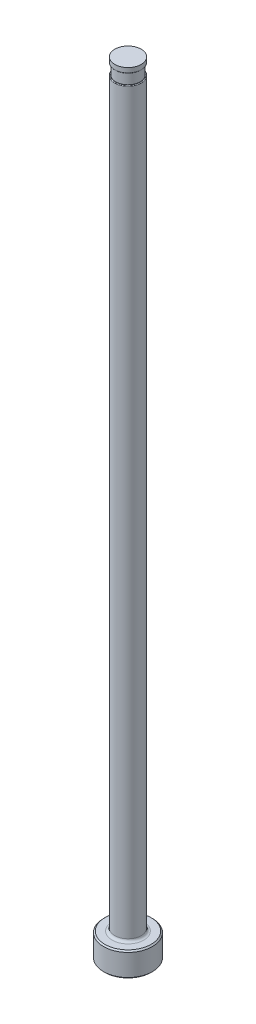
SolidWorks part; units mm, degrees
ref_plane "Front Plane" through (0, 0, 0) normal (0, 0, 1) x (1, 0, 0)
ref_plane "Top Plane" through (0, 0, 0) normal (0, 1, 0) x (1, 0, 0)
ref_plane "Right Plane" through (0, 0, 0) normal (1, 0, 0) x (0, 0, -1)
other "Configuration Table"
sketch "Sketch1" plane through (0, 0, 0) normal (0, 0, 1) x (1, 0, 0)
  line L0 (0, 259.9588) -> (0, -15.1925) construction
  line L1 (0, 0) -> (-4.7625, 0)
  line L2 (-4.7625, 0) -> (-4.7625, 4.7498)
  line L3 (-4.7625, 4.7498) -> (-2.5794, 4.7498)
  line L4 (-2.5794, 4.7498) -> (-2.5794, 152.4)
  line L5 (-2.5794, 152.4) -> (0, 152.4)
  line L6 (0, 152.4) -> (0, 0)
  dimension "L" = 152.4
  dimension "H" = 9.525
  dimension "T" = 4.7498
  dimension "D" = 5.1587
revolve "Revolve1" add sketch "Sketch1" angle 360 about L0
chamfer "Chamfer1" distance 0.254 angle 45 2 edges at (0, 4.7498, 4.7625) (0, 0, 4.7625)
fillet "Fillet1" radius 0.508 1 edges at (0, 4.7498, 2.5794)
sketch "Sketch2" plane through (0, 0, 0) normal (0, 0, 1) x (1, 0, 0)
  line L0 (-2.5794, 152.4) -> (-2.5794, 5.2578) construction
  line L1 (-2.5794, 151.384) -> (-2.3762, 151.384)
  line L2 (-2.5794, 151.384) -> (-2.5794, 149.352)
  line L3 (-2.5794, 149.352) -> (-2.3762, 149.352)
  line L4 (-2.3762, 151.384) -> (-2.3762, 149.352)
  line L5 (2.5794, 152.4) -> (-2.5794, 152.4) construction
  line L6 (0, 153.4483) -> (0, 147.3282) construction
  dimension "D1" = 2.032
  dimension "N" = 1.016
  dimension "FD" = 0.2032
  dimension "D3" = 4.7523
revolve "Vent Relief" cut sketch "Sketch2" angle 360 about L6
sketch "Sketch3" plane through (0, 0, 0) normal (0, 0, 1) x (1, 0, 0)
  line L0 (-2.3762, 150.368) -> (-2.3762, 86.868)
  line L1 (-2.3762, 151.384) -> (-2.3762, 149.352) construction
  line L2 (-2.5794, 149.352) -> (-2.5794, 5.2578) construction
  line L3 (-2.5794, 85.7504) -> (-2.5794, 150.368)
  line L4 (-2.5794, 150.368) -> (-2.3762, 150.368)
  arc A0 (-2.3762, 86.868) -> (-2.5794, 85.7504) centre (-5.5512, 86.868) cw
  dimension "D1" = 3.175
  dimension "D2" = 63.5
extrude "D-Slot" cut sketch "Sketch3" against normal through all both and the other way through all
sketch "Sketch5" plane through (0, 0, 0) normal (0, 0, 1) x (1, 0, 0)
  line L0 (-2.5794, 151.384) -> (2.5794, 151.384) construction
  line L1 (-2.5794, 152.4) -> (-2.5743, 152.4)
  line L2 (-2.5794, 152.4) -> (-2.5794, 151.384)
  line L3 (-2.5794, 151.384) -> (-2.5743, 151.384)
  line L4 (-2.5743, 152.4) -> (-2.5743, 151.384)
  line L5 (0, 152.6877) -> (0, 150.5771) construction
  dimension "VP" = 0.0051
revolve "Vent Diameter" cut sketch "Sketch5" angle 360 about L5
fillet "Fillet2" radius 0.127 2 edges at (2.5794, 149.352, 0) (0, 151.384, 2.5743)
sketch "Pocket Sketch" plane through (0, 0, 0) normal (0, 0, 1) x (1, 0, 0)
  line L0 (-5.1594, 0) -> (-5.1594, 4.7752)
  line L1 (-5.1594, 4.7752) -> (-3.5398, 4.7752)
  line L2 (-2.7778, 5.5372) -> (-2.7778, 22.225)
  line L3 (-2.7778, 22.225) -> (0, 22.225)
  line L4 (0, 22.225) -> (0, 0)
  line L5 (0, 0) -> (-5.1594, 0)
  line L6 (0, 12.6104) -> (0, -2.4989) construction
  line L7 (-4.7625, 4.4958) -> (-4.7625, 0.254) construction
  line L8 (4.5085, 4.7498) -> (-4.5085, 4.7498) construction
  line L9 (-2.5794, 85.7504) -> (-2.5794, 5.2578) construction
  line L10 (-3.5398, 4.7752) -> (-2.7778, 5.5372)
  point P3 (-2.7778, 4.7752)
  dimension "D1" = 10.3187
  dimension "D2" = 0.3969
  dimension "D3" = 0.0254
  dimension "D4" = 0.1984
  dimension "D5" = 5.5556
  dimension "D6" = 22.225
